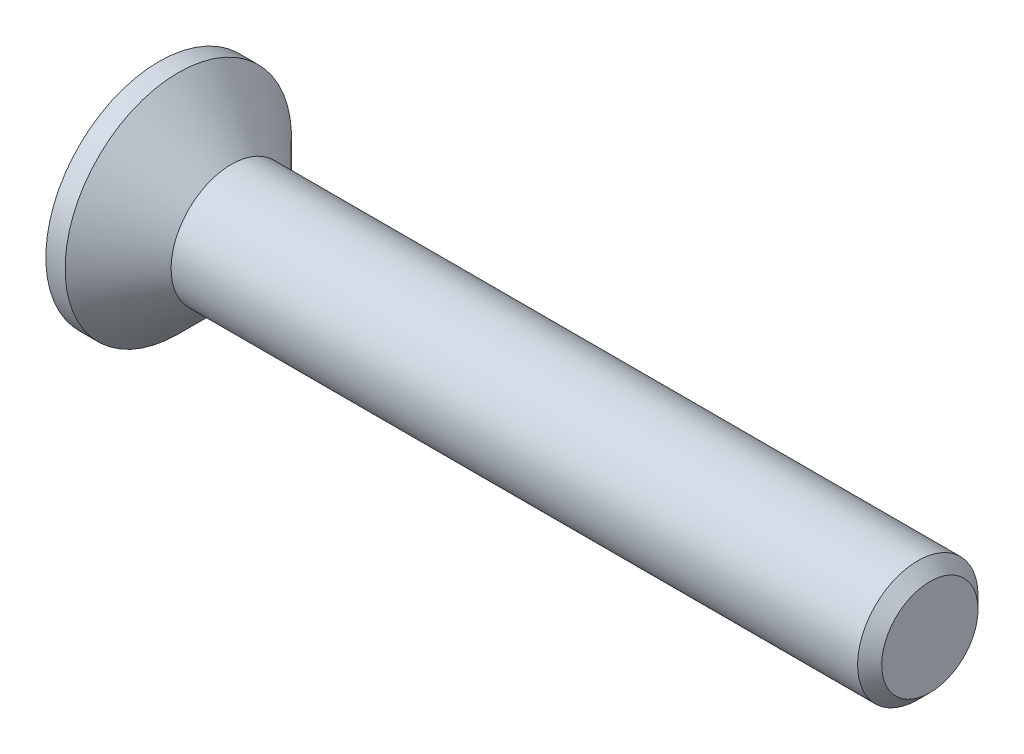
SolidWorks part; units mm, degrees
ref_plane "Front Plane" through (0, 0, 0) normal (0, 0, 1) x (1, 0, 0)
ref_plane "Top Plane" through (0, 0, 0) normal (0, 1, 0) x (1, 0, 0)
ref_plane "Right Plane" through (0, 0, 0) normal (1, 0, 0) x (0, 0, -1)
sketch "Sketch1" plane through (0, 0, 0) normal (0, 0, 1) x (1, 0, 0)
  line L1 (-1.5, 2.35) -> (-1.5, 0)
  line L2 (-1.5, 0) -> (14.5, 0)
  line L3 (14.5, 0) -> (14.5, 1.25)
  line L4 (14.5, 1.25) -> (0, 1.25)
  line L5 (-1.5, 2.35) -> (-1.1, 2.35)
  line L6 (-1.1, 2.35) -> (0, 1.25)
  dimension "D1" = 1.25
  dimension "D2" = 45
  dimension "D3" = 1.5
  dimension "D4" = 16
  dimension "D5" = 2.35
revolve "Revolve1" add sketch "Sketch1" angle 360 about L2
chamfer "Chamfer1" distance 0.25 angle 45 1 edges at (14.5, -1.25, 0)
sketch "Sketch2" plane through (-1.5, 0, 0) normal (-1, 0, 0) x (0, 0, 1)
  line L0 (-0.34, 1.35) -> (0.34, 1.35)
  line L1 (0.34, 1.35) -> (0.34, 0.34)
  line L2 (0.34, 0.34) -> (1.35, 0.34)
  line L3 (1.35, 0.34) -> (1.35, -0.34)
  line L4 (1.35, -0.34) -> (0.34, -0.34)
  line L5 (0.34, -0.34) -> (0.34, -1.35)
  line L6 (0.34, -1.35) -> (-0.34, -1.35)
  line L7 (-0.34, -1.35) -> (-0.34, -0.34)
  line L8 (-0.34, -0.34) -> (-1.35, -0.34)
  line L9 (-1.35, -0.34) -> (-1.35, 0.34)
  line L10 (-1.35, 0.34) -> (-0.34, 0.34)
  line L11 (-0.34, 0.34) -> (-0.34, 1.35)
  point P2 (0, 1.35)
  point P14 (0, -1.35)
  point P15 (1.35, 0)
  point P16 (-1.35, 0)
  dimension "D1" = 2.7
  dimension "D2" = 0.68
extrude "Cut-Extrude1" cut sketch "Sketch2" against normal blind 1.25
